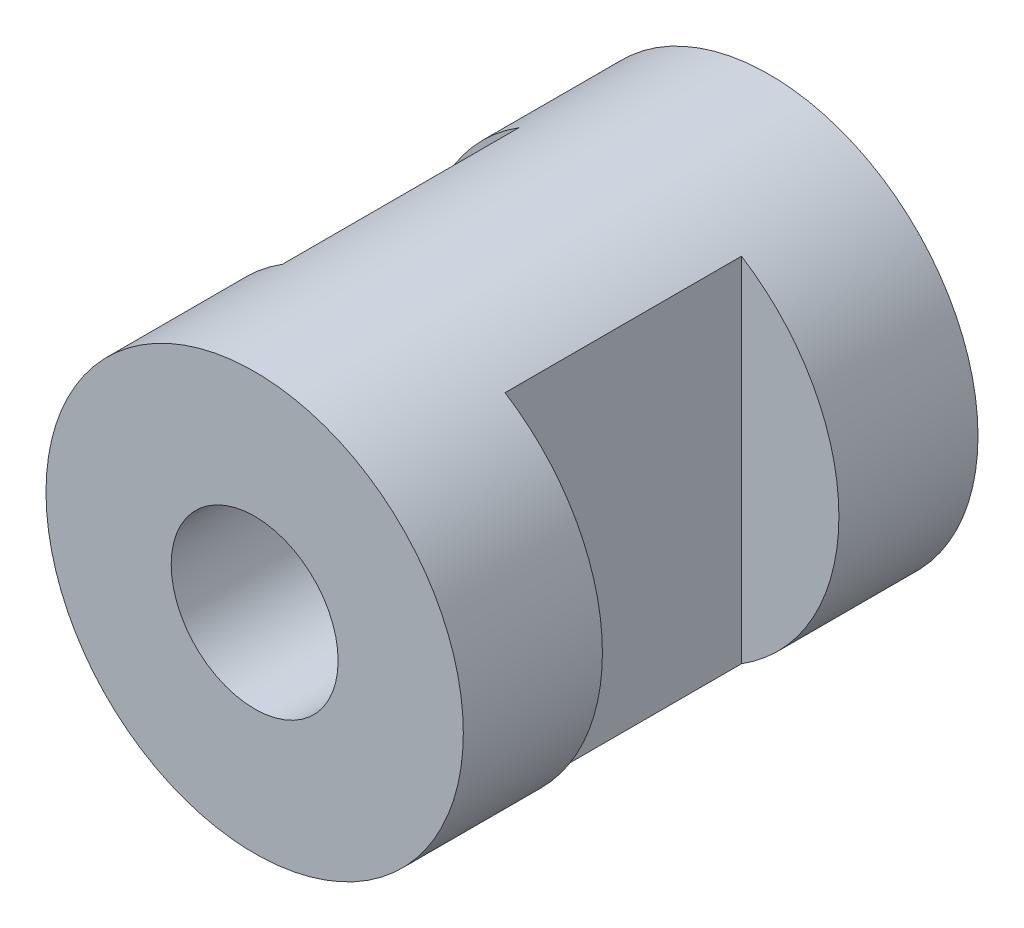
SolidWorks part; units mm, degrees
ref_plane "前视基准面" through (0, 0, 0) normal (0, 0, 1) x (1, 0, 0)
ref_plane "上视基准面" through (0, 0, 0) normal (0, 1, 0) x (1, 0, 0)
ref_plane "右视基准面" through (0, 0, 0) normal (1, 0, 0) x (0, 0, -1)
sketch "草图1" plane through (0, 0, 0) normal (0, 0, 1) x (1, 0, 0)
  circle A0 centre (0, 0) radius 7.5
extrude "凸台-拉伸1" add sketch "草图1" along normal blind 18.5
ref_plane "基准面1" through (0, 10, 0) normal (0, 1, 0) x (-1, 0, 0)
sketch "草图2" plane through (0, 10, 0) normal (0, 1, 0) x (-1, 0, 0)
  line L0 (-7.5, 18.5) -> (-7.5, 0) construction
  line L1 (-9.129, 13.5) -> (-4, 13.5)
  line L2 (-9.129, 13.5) -> (-9.129, 5)
  line L3 (-9.129, 5) -> (-4, 5)
  line L4 (-4, 13.5) -> (-4, 5)
  line L5 (0, 18.5) -> (0, 0) construction
  line L6 (7.5, 18.5) -> (-7.5, 18.5) construction
  line L7 (0, 9.25) -> (7.4929, 9.25) construction
  line L8 (9.129, 13.5) -> (9.129, 5)
  line L9 (9.129, 5) -> (4, 5)
  line L10 (4, 13.5) -> (4, 5)
  line L11 (9.129, 13.5) -> (4, 13.5)
  dimension "D1" = 3.5
  dimension "D2" = 8.5
extrude "切除-拉伸1" cut sketch "草图2" against normal blind 18.5
sketch "草图3" plane through (0, 0, 0) normal (0, 0, -1) x (-1, 0, 0)
  circle A0 centre (0, 0) radius 3
extrude "切除-拉伸2" cut sketch "草图3" against normal blind 18.5
